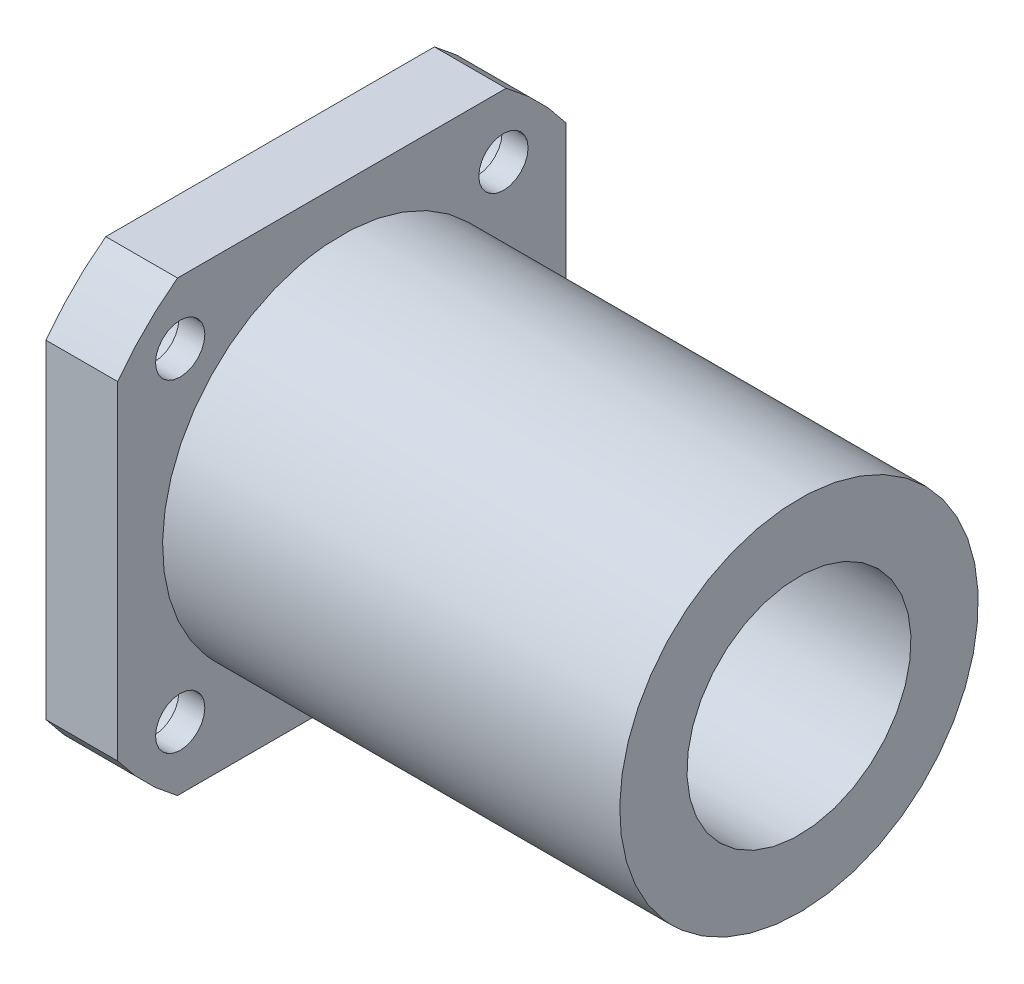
SolidWorks part; units mm, degrees
other "Solid1"
ref_plane "Front Plane" through (0, 0, 0) normal (0, 0, 1) x (1, 0, 0)
ref_plane "Top Plane" through (0, 0, 0) normal (0, 1, 0) x (1, 0, 0)
ref_plane "Right Plane" through (0, 0, 0) normal (1, 0, 0) x (0, 0, -1)
imported_body "2.7051 LMK25UU.stp<1>"
move or copy body "Body-Move/Copy1" bodies to move or copy 101 copy no rotation origin (0, 0, 0) rotation axis (1, 0, 0) rotation angle 45
